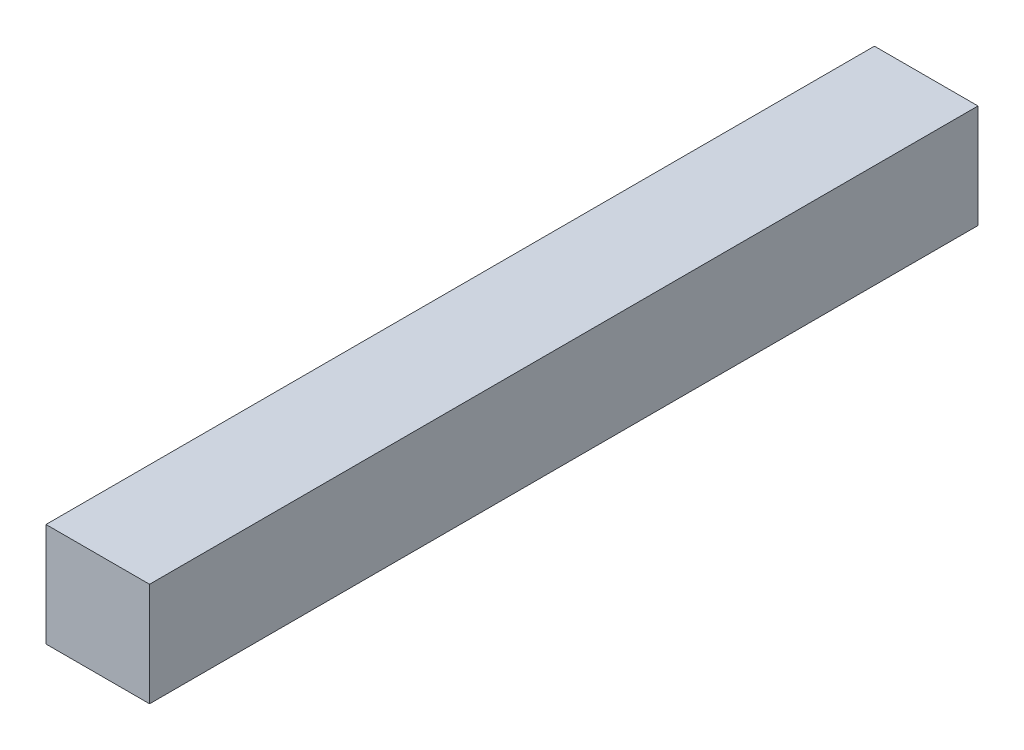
SolidWorks part; units mm, degrees
ref_plane "Face" through (0, 0, 0) normal (0, 0, 1) x (1, 0, 0)
ref_plane "Dessus" through (0, 0, 0) normal (0, 1, 0) x (1, 0, 0)
ref_plane "Droite" through (0, 0, 0) normal (1, 0, 0) x (0, 0, -1)
sketch "Esquisse1" plane through (0, 0, 0) normal (0, 0, 1) x (1, 0, 0)
  line L1 (0, 0) -> (25, 0)
  line L2 (0, 0) -> (0, 25)
  line L3 (0, 25) -> (25, 25)
  line L4 (25, 0) -> (25, 25)
  dimension "D1" = 25
  dimension "D2" = 25
extrude "Extrusion1" add sketch "Esquisse1" along normal blind 200
